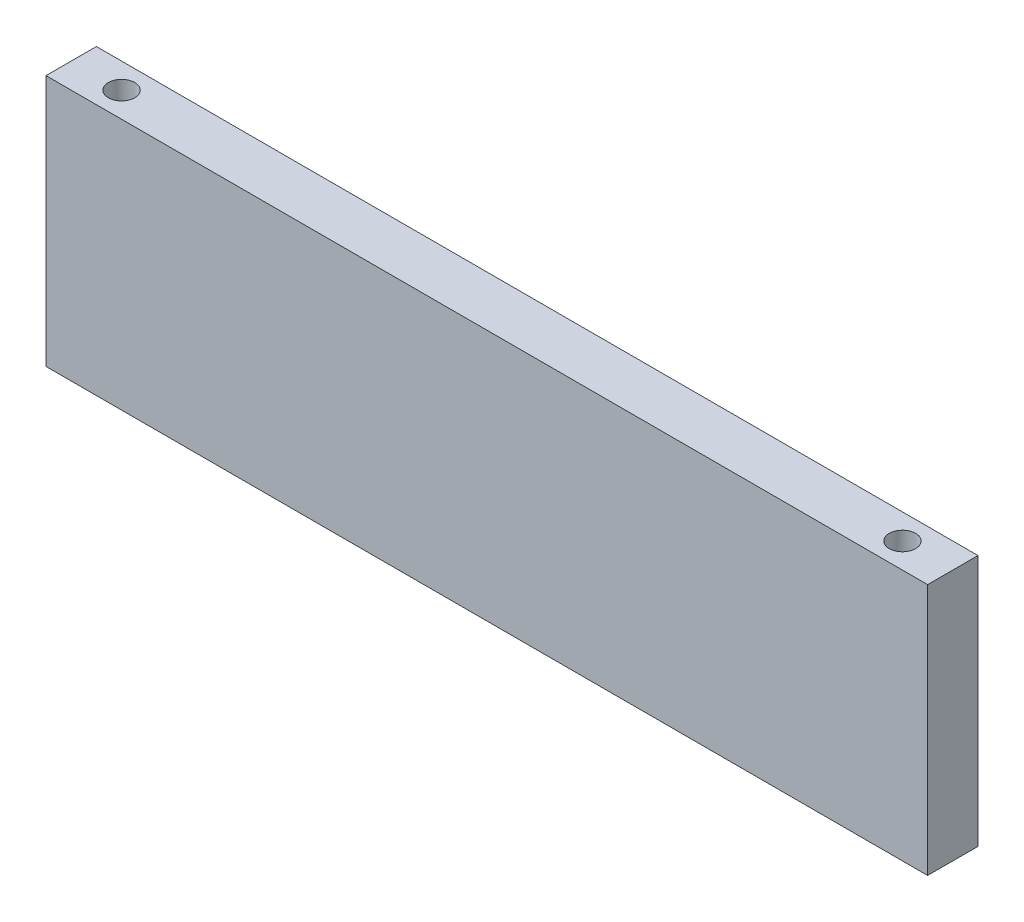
SolidWorks part; units mm, degrees
ref_plane "Przednia" through (0, 0, 0) normal (0, 0, 1) x (1, 0, 0)
ref_plane "Górna" through (0, 0, 0) normal (0, 1, 0) x (1, 0, 0)
ref_plane "Prawa" through (0, 0, 0) normal (1, 0, 0) x (0, 0, -1)
sketch "Szkic1" plane through (0, 0, 0) normal (0, 0, 1) x (1, 0, 0)
  line L1 (0, 0) -> (140, 0)
  line L2 (0, 0) -> (0, 40)
  line L3 (0, 40) -> (140, 40)
  line L4 (140, 0) -> (140, 40)
  dimension "D1" = 40
  dimension "D2" = 140
extrude "Dodanie-wyciągnięcie1" add sketch "Szkic1" along normal blind 8
hole_wizard "Otwór gwintowany M5x0.81" positions "Szkic3" profile "Szkic2" tap size "M5x0.8" standard "Ansi Metric"
sketch "Szkic3" plane through (0, 0, 0) normal (0, -1, 0) x (-1, 0, 0)
  line L0 (-140, -4) -> (-132, -4) construction
  line L1 (-140, -8) -> (-140, 0) construction
  line L2 (-132, -4) -> (-102, -4) construction
  line L3 (-102, -4) -> (-38, -4) construction
  line L4 (-38, -4) -> (-8, -4) construction
  line L7 (-70, -4) -> (-70, -8) construction
  line L8 (0, -8) -> (-140, -8) construction
  point P0 (-8, -4)
  point P6 (-132, -4)
  dimension "D1" = 64
  dimension "D2" = 30
  dimension "D3" = 30
sketch "Szkic2" plane through (8, 0, 4) normal (1, 0, 0) x (0, 0, -1)
  line L0 (0, 0) -> (0, 15.2618)
  line L1 (0, 15.2618) -> (2.1, 14)
  line L2 (2.1, 14) -> (2.1, 0)
  line L5 (2.1, 0) -> (0, 0)
  line L10 (0, 15.2618) -> (-2.1, 14) construction
  line L11 (0, -6.35) -> (0, 107.95) construction
  dimension "Średnica wiertła gwintu" = 4.2
  dimension "Głębokość otworu gwintowanego" = 14
  dimension "Kąt wiertła" = 118
hole_wizard "Otwór gwintowany M5x0.82" positions "Szkic5" profile "Szkic4" tap size "M5x0.8" standard "Ansi Metric"
sketch "Szkic5" plane through (0, 40, 0) normal (0, 1, 0) x (1, 0, 0)
  line L0 (8, -4) -> (132, -4) construction
  line L2 (70, -4) -> (70, 0) construction
  line L3 (140, 0) -> (0, 0) construction
  point P0 (132, -4)
  point P3 (8, -4)
  dimension "D1" = 124
  dimension "D2" = 4
sketch "Szkic4" plane through (132, 40, 4) normal (1, 0, 0) x (0, 0, 1)
  line L0 (0, 0) -> (0, 15.2618)
  line L1 (0, 15.2618) -> (2.1, 14)
  line L2 (2.1, 14) -> (2.1, 0)
  line L5 (2.1, 0) -> (0, 0)
  line L10 (0, 15.2618) -> (-2.1, 14) construction
  line L11 (0, -6.35) -> (0, 107.95) construction
  dimension "Średnica wiertła gwintu" = 4.2
  dimension "Głębokość otworu gwintowanego" = 14
  dimension "Kąt wiertła" = 118
